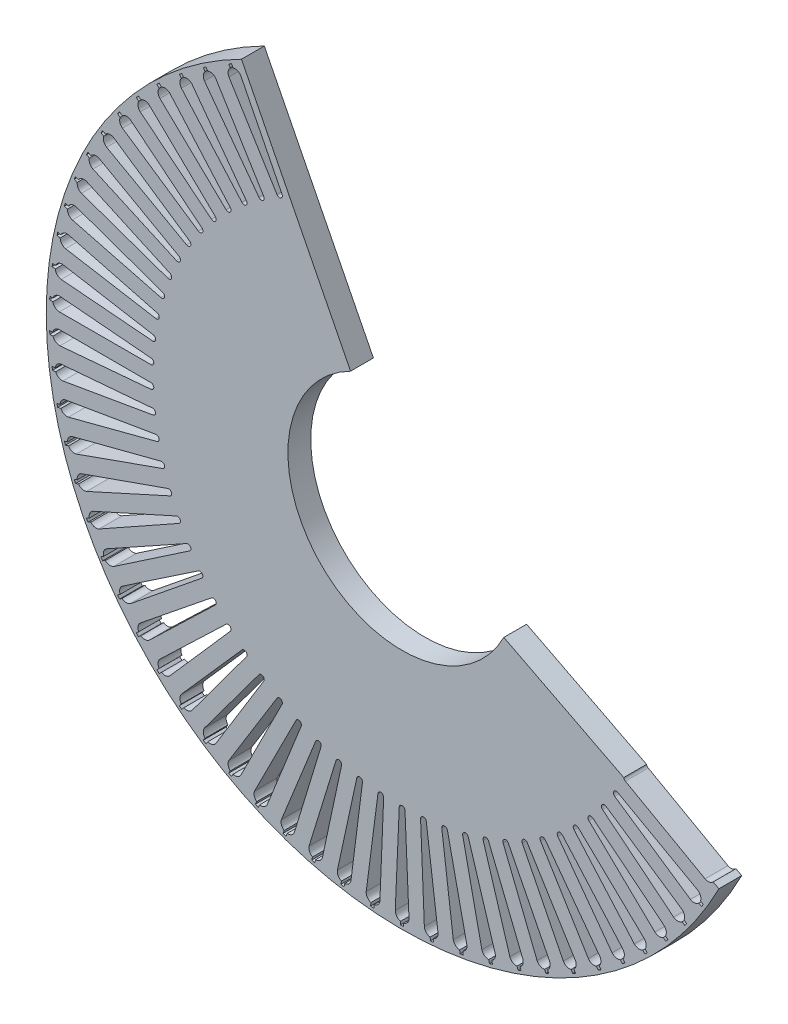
SolidWorks part; units mm, degrees
ref_plane "Přední rovina" through (0, 0, 0) normal (0, 0, 1) x (1, 0, 0)
ref_plane "Horní rovina" through (0, 0, 0) normal (0, 1, 0) x (1, 0, 0)
ref_plane "Pravá rovina" through (0, 0, 0) normal (1, 0, 0) x (0, 0, -1)
sketch "Skica2" plane through (0, 0, 0) normal (0, 0, 1) x (1, 0, 0)
  circle A0 centre (0, 0) radius 25
  circle A1 centre (0, 0) radius 77.9
extrude "Přidat vysunutím1" add sketch "Skica2" along normal blind 5
sketch "Skica1" plane through (0, 0, 0) normal (0, 0, 1) x (1, 0, 0)
  line L0 (0, 94.0554) -> (0, -97.5291) construction
  line L1 (-111.4898, 0) -> (131.9321, 0) construction
  line L2 (0, 77.9) -> (0, 77.2)
  line L3 (-0.35, 77.2) -> (0.35, 77.2)
  line L4 (0.35, 77.2) -> (0.35, 76.5)
  line L5 (0, 76.5) -> (0, 75.0365)
  line L6 (0, 75.0365) -> (0, 55.0346)
  line L7 (1.5047, 75.0365) -> (0.63, 55.0346)
  line L8 (-1.5047, 75.0365) -> (-0.63, 55.0346)
  line L9 (-0.35, 77.2) -> (-0.35, 76.5)
  line L10 (4.8642, 74.8938) -> (4.0395, 54.8898)
  line L11 (7.8629, 74.6386) -> (5.295, 54.7829)
  line L12 (6.8958, 76.8922) -> (6.8364, 76.1947)
  line L13 (6.1983, 76.9516) -> (6.1389, 76.2541)
  line L14 (6.1983, 76.9516) -> (6.8958, 76.8922)
  line L15 (11.1981, 74.2115) -> (8.68, 54.3495)
  line L16 (14.1643, 73.7029) -> (9.9218, 54.1365)
  line L17 (13.3918, 76.0304) -> (13.2735, 75.3405)
  line L18 (12.7019, 76.1487) -> (12.5836, 75.4588)
  line L19 (12.7019, 76.1487) -> (13.3918, 76.0304)
  line L20 (17.4514, 72.9945) -> (13.2578, 53.4176)
  line L21 (20.3637, 72.2362) -> (14.4772, 53.1001)
  line L22 (19.7914, 74.6208) -> (19.615, 73.9434)
  line L23 (19.114, 74.7972) -> (18.9376, 74.1198)
  line L24 (19.114, 74.7972) -> (19.7914, 74.6208)
  line L25 (23.5789, 71.2515) -> (17.7402, 52.1008)
  line L26 (26.4164, 70.249) -> (18.9282, 51.681)
  line L27 (26.0484, 72.6735) -> (25.8152, 72.0135)
  line L28 (25.3884, 72.9067) -> (25.1552, 72.2467)
  line L29 (25.3884, 72.9067) -> (26.0484, 72.6735)
  line L30 (29.5365, 68.9952) -> (22.0948, 50.4086)
  line L31 (32.2788, 67.7556) -> (23.2429, 49.8896)
  line L32 (32.1177, 70.2027) -> (31.8294, 69.5648)
  line L33 (31.4798, 70.491) -> (31.1915, 69.8531)
  line L34 (31.4798, 70.491) -> (32.1177, 70.2027)
  line L35 (35.2813, 66.2418) -> (26.2901, 48.3533)
  line L36 (37.9086, 64.7741) -> (27.3901, 47.7388)
  line L37 (37.9556, 67.226) -> (37.6142, 66.6149)
  line L38 (37.3445, 67.5674) -> (37.0031, 66.9563)
  line L39 (37.3445, 67.5674) -> (37.9556, 67.226)
  line L40 (40.7719, 63.0111) -> (30.296, 45.9495)
  line L41 (43.2653, 61.3259) -> (31.34, 45.2439)
  line L42 (43.52, 63.765) -> (43.128, 63.185)
  line L43 (42.9401, 64.1569) -> (42.5481, 63.577)
  line L44 (42.9401, 64.1569) -> (43.52, 63.765)
  line L45 (45.9687, 59.3264) -> (34.0837, 43.2147)
  line L46 (48.3102, 57.4358) -> (35.064, 42.4231)
  line L47 (48.7709, 59.8445) -> (48.3311, 59.2999)
  line L48 (48.2263, 60.2842) -> (47.7865, 59.7396)
  line L49 (48.2263, 60.2842) -> (48.7709, 59.8445)
  line L50 (50.8343, 55.2143) -> (37.6258, 40.1685)
  line L51 (53.007, 53.1319) -> (38.5354, 39.2967)
  line L52 (53.6704, 55.4928) -> (53.186, 54.9875)
  line L53 (53.165, 55.9772) -> (52.6806, 55.4718)
  line L54 (53.165, 55.9772) -> (53.6704, 55.4928)
  line L55 (55.3337, 50.7043) -> (40.8967, 36.8329)
  line L56 (57.322, 48.4452) -> (41.7292, 35.8871)
  line L57 (58.1831, 50.7414) -> (57.6577, 50.2789)
  line L58 (57.7207, 51.2668) -> (57.1952, 50.8044)
  line L59 (57.7207, 51.2668) -> (58.1831, 50.7414)
  line L60 (59.4344, 45.829) -> (43.8731, 33.2319)
  line L61 (61.2239, 43.4094) -> (44.6223, 32.2189)
  line L62 (62.2767, 45.6243) -> (61.7139, 45.208)
  line L63 (61.8605, 46.1871) -> (61.2977, 45.7708)
  line L64 (61.8605, 46.1871) -> (62.2767, 45.6243)
  line L65 (63.1068, 40.6235) -> (46.5333, 29.3915)
  line L66 (64.6847, 38.0609) -> (47.1939, 28.3186)
  line L67 (65.9216, 40.1785) -> (65.3255, 39.8115)
  line L68 (65.5545, 40.7746) -> (64.9585, 40.4075)
  line L69 (65.5545, 40.7746) -> (65.9216, 40.1785)
  line L70 (66.3246, 35.1253) -> (48.8582, 25.3393)
  line L71 (67.6795, 32.4381) -> (49.4255, 24.2143)
  line L72 (69.0914, 34.4432) -> (68.4664, 34.1281)
  line L73 (68.7763, 35.0683) -> (68.1513, 34.7531)
  line L74 (68.7763, 35.0683) -> (69.0914, 34.4432)
  line L75 (69.0645, 29.3741) -> (50.8311, 21.1046)
  line L76 (70.1866, 26.5816) -> (51.3009, 19.9354)
  line L77 (71.7635, 28.4598) -> (71.114, 28.1988)
  line L78 (71.5025, 29.1093) -> (70.853, 28.8483)
  line L79 (71.5025, 29.1093) -> (71.7635, 28.4598)
  line L80 (71.3068, 23.4112) -> (52.4378, 16.7178)
  line L81 (72.1881, 20.5336) -> (52.8068, 15.513)
  line L82 (73.9186, 22.2713) -> (73.2492, 22.0663)
  line L83 (73.7136, 22.9406) -> (73.0443, 22.7356)
  line L84 (73.7136, 22.9406) -> (73.9186, 22.2713)
  line L85 (73.0353, 17.2796) -> (53.6667, 12.2105)
  line L86 (73.6694, 14.3377) -> (53.9321, 10.9788)
  line L87 (75.541, 15.9223) -> (74.8567, 15.7748)
  line L88 (75.3935, 16.6066) -> (74.7092, 16.4591)
  line L89 (75.3935, 16.6066) -> (75.541, 15.9223)
  line L90 (74.2376, 11.0235) -> (54.5088, 7.6153)
  line L91 (74.6199, 8.0384) -> (54.6689, 6.3655)
  line L92 (76.6192, 9.4586) -> (75.9248, 9.3697)
  line L93 (76.5303, 10.1529) -> (75.8359, 10.064)
  line L94 (76.5303, 10.1529) -> (76.6192, 9.4586)
  line L95 (74.9051, 4.688) -> (54.9583, 2.9652)
  line L96 (75.0328, 1.6813) -> (55.0118, 1.7063)
  line L97 (77.1453, 2.9268) -> (76.4459, 2.8971)
  line L98 (77.1156, 3.6261) -> (76.4162, 3.5964)
  line L99 (77.1156, 3.6261) -> (77.1453, 2.9268)
  line L100 (75.0328, -1.6813) -> (55.0118, -1.7063)
  line L101 (74.9051, -4.688) -> (54.9583, -2.9652)
  line L102 (77.1156, -3.6261) -> (76.4162, -3.5964)
  line L103 (77.1453, -2.9268) -> (76.4459, -2.8971)
  line L104 (77.1453, -2.9268) -> (77.1156, -3.6261)
  line L105 (74.6199, -8.0384) -> (54.6689, -6.3655)
  line L106 (74.2376, -11.0235) -> (54.5088, -7.6153)
  line L107 (76.5303, -10.1529) -> (75.8359, -10.064)
  line L108 (76.6192, -9.4586) -> (75.9248, -9.3697)
  line L109 (76.6192, -9.4586) -> (76.5303, -10.1529)
  line L110 (73.6694, -14.3377) -> (53.9321, -10.9788)
  line L111 (73.0353, -17.2796) -> (53.6667, -12.2105)
  line L112 (75.3935, -16.6066) -> (74.7092, -16.4591)
  line L113 (75.541, -15.9223) -> (74.8567, -15.7748)
  line L114 (75.541, -15.9223) -> (75.3935, -16.6066)
  line L115 (72.1881, -20.5336) -> (52.8068, -15.513)
  line L116 (71.3068, -23.4112) -> (52.4378, -16.7178)
  line L117 (73.7136, -22.9406) -> (73.0443, -22.7356)
  line L118 (73.9186, -22.2713) -> (73.2492, -22.0663)
  line L119 (73.9186, -22.2713) -> (73.7136, -22.9406)
  line L120 (70.1866, -26.5816) -> (51.3009, -19.9354)
  line L121 (69.0645, -29.3741) -> (50.8311, -21.1046)
  line L122 (71.5025, -29.1093) -> (70.853, -28.8483)
  line L123 (71.7635, -28.4598) -> (71.114, -28.1988)
  line L124 (71.7635, -28.4598) -> (71.5025, -29.1093)
  line L125 (67.6795, -32.4381) -> (49.4255, -24.2143)
  line L126 (66.3246, -35.1253) -> (48.8582, -25.3393)
  line L127 (68.7763, -35.0683) -> (68.1513, -34.7531)
  line L128 (69.0914, -34.4432) -> (68.4664, -34.1281)
  line L129 (69.0914, -34.4432) -> (68.7763, -35.0683)
  line L130 (64.6847, -38.0609) -> (47.1939, -28.3186)
  line L131 (63.1068, -40.6235) -> (46.5333, -29.3915)
  line L132 (65.5545, -40.7746) -> (64.9585, -40.4075)
  line L133 (65.9216, -40.1785) -> (65.3255, -39.8115)
  line L134 (65.9216, -40.1785) -> (65.5545, -40.7746)
  line L135 (61.2239, -43.4094) -> (44.6223, -32.2189)
  line L136 (59.4344, -45.829) -> (43.8731, -33.2319)
  line L137 (61.8605, -46.1871) -> (61.2977, -45.7708)
  line L138 (62.2767, -45.6243) -> (61.7139, -45.208)
  line L139 (62.2767, -45.6243) -> (61.8605, -46.1871)
  line L140 (57.322, -48.4452) -> (41.7292, -35.8871)
  line L141 (55.3337, -50.7043) -> (40.8967, -36.8329)
  line L142 (57.7207, -51.2668) -> (57.1952, -50.8044)
  line L143 (58.1831, -50.7414) -> (57.6577, -50.2789)
  line L144 (58.1831, -50.7414) -> (57.7207, -51.2668)
  line L145 (53.007, -53.1319) -> (38.5354, -39.2967)
  line L146 (50.8343, -55.2143) -> (37.6258, -40.1685)
  line L147 (53.165, -55.9772) -> (52.6806, -55.4718)
  line L148 (53.6704, -55.4928) -> (53.186, -54.9875)
  line L149 (53.6704, -55.4928) -> (53.165, -55.9772)
  line L150 (48.3102, -57.4358) -> (35.064, -42.4231)
  line L151 (45.9687, -59.3264) -> (34.0837, -43.2147)
  line L152 (48.2263, -60.2842) -> (47.7865, -59.7396)
  line L153 (48.7709, -59.8445) -> (48.3311, -59.2999)
  line L154 (48.7709, -59.8445) -> (48.2263, -60.2842)
  line L155 (43.2653, -61.3259) -> (31.34, -45.2439)
  line L156 (40.7719, -63.0111) -> (30.296, -45.9495)
  line L157 (42.9401, -64.1569) -> (42.5481, -63.577)
  line L158 (43.52, -63.765) -> (43.128, -63.185)
  line L159 (43.52, -63.765) -> (42.9401, -64.1569)
  line L160 (37.9086, -64.7741) -> (27.3901, -47.7388)
  line L161 (35.2813, -66.2418) -> (26.2901, -48.3533)
  line L162 (37.3445, -67.5674) -> (37.0031, -66.9563)
  line L163 (37.9556, -67.226) -> (37.6142, -66.6149)
  line L164 (37.9556, -67.226) -> (37.3445, -67.5674)
  line L165 (32.2788, -67.7556) -> (23.2429, -49.8896)
  line L166 (29.5365, -68.9952) -> (22.0948, -50.4086)
  line L167 (31.4798, -70.491) -> (31.1915, -69.8531)
  line L168 (32.1177, -70.2027) -> (31.8294, -69.5648)
  line L169 (32.1177, -70.2027) -> (31.4798, -70.491)
  line L170 (26.4164, -70.249) -> (18.9282, -51.681)
  line L171 (23.5789, -71.2515) -> (17.7402, -52.1008)
  line L172 (25.3884, -72.9067) -> (25.1552, -72.2467)
  line L173 (26.0484, -72.6735) -> (25.8152, -72.0135)
  line L174 (26.0484, -72.6735) -> (25.3884, -72.9067)
  line L175 (20.3637, -72.2362) -> (14.4772, -53.1001)
  line L176 (17.4514, -72.9945) -> (13.2578, -53.4176)
  line L177 (19.114, -74.7972) -> (18.9376, -74.1198)
  line L178 (19.7914, -74.6208) -> (19.615, -73.9434)
  line L179 (19.7914, -74.6208) -> (19.114, -74.7972)
  line L180 (14.1643, -73.7029) -> (9.9218, -54.1365)
  line L181 (11.1981, -74.2115) -> (8.68, -54.3495)
  line L182 (12.7019, -76.1487) -> (12.5836, -75.4588)
  line L183 (13.3918, -76.0304) -> (13.2735, -75.3405)
  line L184 (13.3918, -76.0304) -> (12.7019, -76.1487)
  line L185 (7.8629, -74.6386) -> (5.295, -54.7829)
  line L186 (4.8642, -74.8938) -> (4.0395, -54.8898)
  line L187 (6.1983, -76.9516) -> (6.1389, -76.2541)
  line L188 (6.8958, -76.8922) -> (6.8364, -76.1947)
  line L189 (6.8958, -76.8922) -> (6.1983, -76.9516)
  line L190 (1.5047, -75.0365) -> (0.63, -55.0346)
  line L191 (-1.5047, -75.0365) -> (-0.63, -55.0346)
  line L192 (-0.35, -77.2) -> (-0.35, -76.5)
  line L193 (0.35, -77.2) -> (0.35, -76.5)
  line L194 (0.35, -77.2) -> (-0.35, -77.2)
  line L195 (-4.8642, -74.8938) -> (-4.0395, -54.8898)
  line L196 (-7.8629, -74.6386) -> (-5.295, -54.7829)
  line L197 (-6.8958, -76.8922) -> (-6.8364, -76.1947)
  line L198 (-6.1983, -76.9516) -> (-6.1389, -76.2541)
  line L199 (-6.1983, -76.9516) -> (-6.8958, -76.8922)
  line L200 (-11.1981, -74.2115) -> (-8.68, -54.3495)
  line L201 (-14.1643, -73.7029) -> (-9.9218, -54.1365)
  line L202 (-13.3918, -76.0304) -> (-13.2735, -75.3405)
  line L203 (-12.7019, -76.1487) -> (-12.5836, -75.4588)
  line L204 (-12.7019, -76.1487) -> (-13.3918, -76.0304)
  line L205 (-17.4514, -72.9945) -> (-13.2578, -53.4176)
  line L206 (-20.3637, -72.2362) -> (-14.4772, -53.1001)
  line L207 (-19.7914, -74.6208) -> (-19.615, -73.9434)
  line L208 (-19.114, -74.7972) -> (-18.9376, -74.1198)
  line L209 (-19.114, -74.7972) -> (-19.7914, -74.6208)
  line L210 (-23.5789, -71.2515) -> (-17.7402, -52.1008)
  line L211 (-26.4164, -70.249) -> (-18.9282, -51.681)
  line L212 (-26.0484, -72.6735) -> (-25.8152, -72.0135)
  line L213 (-25.3884, -72.9067) -> (-25.1552, -72.2467)
  line L214 (-25.3884, -72.9067) -> (-26.0484, -72.6735)
  line L215 (-29.5365, -68.9952) -> (-22.0948, -50.4086)
  line L216 (-32.2788, -67.7556) -> (-23.2429, -49.8896)
  line L217 (-32.1177, -70.2027) -> (-31.8294, -69.5648)
  line L218 (-31.4798, -70.491) -> (-31.1915, -69.8531)
  line L219 (-31.4798, -70.491) -> (-32.1177, -70.2027)
  line L220 (-35.2813, -66.2418) -> (-26.2901, -48.3533)
  line L221 (-37.9086, -64.7741) -> (-27.3901, -47.7388)
  line L222 (-37.9556, -67.226) -> (-37.6142, -66.6149)
  line L223 (-37.3445, -67.5674) -> (-37.0031, -66.9563)
  line L224 (-37.3445, -67.5674) -> (-37.9556, -67.226)
  line L225 (-40.7719, -63.0111) -> (-30.296, -45.9495)
  line L226 (-43.2653, -61.3259) -> (-31.34, -45.2439)
  line L227 (-43.52, -63.765) -> (-43.128, -63.185)
  line L228 (-42.9401, -64.1569) -> (-42.5481, -63.577)
  line L229 (-42.9401, -64.1569) -> (-43.52, -63.765)
  line L230 (-45.9687, -59.3264) -> (-34.0837, -43.2147)
  line L231 (-48.3102, -57.4358) -> (-35.064, -42.4231)
  line L232 (-48.7709, -59.8445) -> (-48.3311, -59.2999)
  line L233 (-48.2263, -60.2842) -> (-47.7865, -59.7396)
  line L234 (-48.2263, -60.2842) -> (-48.7709, -59.8445)
  line L235 (-50.8343, -55.2143) -> (-37.6258, -40.1685)
  line L236 (-53.007, -53.1319) -> (-38.5354, -39.2967)
  line L237 (-53.6704, -55.4928) -> (-53.186, -54.9875)
  line L238 (-53.165, -55.9772) -> (-52.6806, -55.4718)
  line L239 (-53.165, -55.9772) -> (-53.6704, -55.4928)
  line L240 (-55.3337, -50.7043) -> (-40.8967, -36.8329)
  line L241 (-57.322, -48.4452) -> (-41.7292, -35.8871)
  line L242 (-58.1831, -50.7414) -> (-57.6577, -50.2789)
  line L243 (-57.7207, -51.2668) -> (-57.1952, -50.8044)
  line L244 (-57.7207, -51.2668) -> (-58.1831, -50.7414)
  line L245 (-59.4344, -45.829) -> (-43.8731, -33.2319)
  line L246 (-61.2239, -43.4094) -> (-44.6223, -32.2189)
  line L247 (-62.2767, -45.6243) -> (-61.7139, -45.208)
  line L248 (-61.8605, -46.1871) -> (-61.2977, -45.7708)
  line L249 (-61.8605, -46.1871) -> (-62.2767, -45.6243)
  line L250 (-63.1068, -40.6235) -> (-46.5333, -29.3915)
  line L251 (-64.6847, -38.0609) -> (-47.1939, -28.3186)
  line L252 (-65.9216, -40.1785) -> (-65.3255, -39.8115)
  line L253 (-65.5545, -40.7746) -> (-64.9585, -40.4075)
  line L254 (-65.5545, -40.7746) -> (-65.9216, -40.1785)
  line L255 (-66.3246, -35.1253) -> (-48.8582, -25.3393)
  line L256 (-67.6795, -32.4381) -> (-49.4255, -24.2143)
  line L257 (-69.0914, -34.4432) -> (-68.4664, -34.1281)
  line L258 (-68.7763, -35.0683) -> (-68.1513, -34.7531)
  line L259 (-68.7763, -35.0683) -> (-69.0914, -34.4432)
  line L260 (-69.0645, -29.3741) -> (-50.8311, -21.1046)
  line L261 (-70.1866, -26.5816) -> (-51.3009, -19.9354)
  line L262 (-71.7635, -28.4598) -> (-71.114, -28.1988)
  line L263 (-71.5025, -29.1093) -> (-70.853, -28.8483)
  line L264 (-71.5025, -29.1093) -> (-71.7635, -28.4598)
  line L265 (-71.3068, -23.4112) -> (-52.4378, -16.7178)
  line L266 (-72.1881, -20.5336) -> (-52.8068, -15.513)
  line L267 (-73.9186, -22.2713) -> (-73.2492, -22.0663)
  line L268 (-73.7136, -22.9406) -> (-73.0443, -22.7356)
  line L269 (-73.7136, -22.9406) -> (-73.9186, -22.2713)
  line L270 (-73.0353, -17.2796) -> (-53.6667, -12.2105)
  line L271 (-73.6694, -14.3377) -> (-53.9321, -10.9788)
  line L272 (-75.541, -15.9223) -> (-74.8567, -15.7748)
  line L273 (-75.3935, -16.6066) -> (-74.7092, -16.4591)
  line L274 (-75.3935, -16.6066) -> (-75.541, -15.9223)
  line L275 (-74.2376, -11.0235) -> (-54.5088, -7.6153)
  line L276 (-74.6199, -8.0384) -> (-54.6689, -6.3655)
  line L277 (-76.6192, -9.4586) -> (-75.9248, -9.3697)
  line L278 (-76.5303, -10.1529) -> (-75.8359, -10.064)
  line L279 (-76.5303, -10.1529) -> (-76.6192, -9.4586)
  line L280 (-74.9051, -4.688) -> (-54.9583, -2.9652)
  line L281 (-75.0328, -1.6813) -> (-55.0118, -1.7063)
  line L282 (-77.1453, -2.9268) -> (-76.4459, -2.8971)
  line L283 (-77.1156, -3.6261) -> (-76.4162, -3.5964)
  line L284 (-77.1156, -3.6261) -> (-77.1453, -2.9268)
  line L285 (-75.0328, 1.6813) -> (-55.0118, 1.7063)
  line L286 (-74.9051, 4.688) -> (-54.9583, 2.9652)
  line L287 (-77.1156, 3.6261) -> (-76.4162, 3.5964)
  line L288 (-77.1453, 2.9268) -> (-76.4459, 2.8971)
  line L289 (-77.1453, 2.9268) -> (-77.1156, 3.6261)
  line L290 (-74.6199, 8.0384) -> (-54.6689, 6.3655)
  line L291 (-74.2376, 11.0235) -> (-54.5088, 7.6153)
  line L292 (-76.5303, 10.1529) -> (-75.8359, 10.064)
  line L293 (-76.6192, 9.4586) -> (-75.9248, 9.3697)
  line L294 (-76.6192, 9.4586) -> (-76.5303, 10.1529)
  line L295 (-73.6694, 14.3377) -> (-53.9321, 10.9788)
  line L296 (-73.0353, 17.2796) -> (-53.6667, 12.2105)
  line L297 (-75.3935, 16.6066) -> (-74.7092, 16.4591)
  line L298 (-75.541, 15.9223) -> (-74.8567, 15.7748)
  line L299 (-75.541, 15.9223) -> (-75.3935, 16.6066)
  line L300 (-72.1881, 20.5336) -> (-52.8068, 15.513)
  line L301 (-71.3068, 23.4112) -> (-52.4378, 16.7178)
  line L302 (-73.7136, 22.9406) -> (-73.0443, 22.7356)
  line L303 (-73.9186, 22.2713) -> (-73.2492, 22.0663)
  line L304 (-73.9186, 22.2713) -> (-73.7136, 22.9406)
  line L305 (-70.1866, 26.5816) -> (-51.3009, 19.9354)
  line L306 (-69.0645, 29.3741) -> (-50.8311, 21.1046)
  line L307 (-71.5025, 29.1093) -> (-70.853, 28.8483)
  line L308 (-71.7635, 28.4598) -> (-71.114, 28.1988)
  line L309 (-71.7635, 28.4598) -> (-71.5025, 29.1093)
  line L310 (-67.6795, 32.4381) -> (-49.4255, 24.2143)
  line L311 (-66.3246, 35.1253) -> (-48.8582, 25.3393)
  line L312 (-68.7763, 35.0683) -> (-68.1513, 34.7531)
  line L313 (-69.0914, 34.4432) -> (-68.4664, 34.1281)
  line L314 (-69.0914, 34.4432) -> (-68.7763, 35.0683)
  line L315 (-64.6847, 38.0609) -> (-47.1939, 28.3186)
  line L316 (-63.1068, 40.6235) -> (-46.5333, 29.3915)
  line L317 (-65.5545, 40.7746) -> (-64.9585, 40.4075)
  line L318 (-65.9216, 40.1785) -> (-65.3255, 39.8115)
  line L319 (-65.9216, 40.1785) -> (-65.5545, 40.7746)
  line L320 (-61.2239, 43.4094) -> (-44.6223, 32.2189)
  line L321 (-59.4344, 45.829) -> (-43.8731, 33.2319)
  line L322 (-61.8605, 46.1871) -> (-61.2977, 45.7708)
  line L323 (-62.2767, 45.6243) -> (-61.7139, 45.208)
  line L324 (-62.2767, 45.6243) -> (-61.8605, 46.1871)
  line L325 (-57.322, 48.4452) -> (-41.7292, 35.8871)
  line L326 (-55.3337, 50.7043) -> (-40.8967, 36.8329)
  line L327 (-57.7207, 51.2668) -> (-57.1952, 50.8044)
  line L328 (-58.1831, 50.7414) -> (-57.6577, 50.2789)
  line L329 (-58.1831, 50.7414) -> (-57.7207, 51.2668)
  line L330 (-53.007, 53.1319) -> (-38.5354, 39.2967)
  line L331 (-50.8343, 55.2143) -> (-37.6258, 40.1685)
  line L332 (-53.165, 55.9772) -> (-52.6806, 55.4718)
  line L333 (-53.6704, 55.4928) -> (-53.186, 54.9875)
  line L334 (-53.6704, 55.4928) -> (-53.165, 55.9772)
  line L335 (-48.3102, 57.4358) -> (-35.064, 42.4231)
  line L336 (-45.9687, 59.3264) -> (-34.0837, 43.2147)
  line L337 (-48.2263, 60.2842) -> (-47.7865, 59.7396)
  line L338 (-48.7709, 59.8445) -> (-48.3311, 59.2999)
  line L339 (-48.7709, 59.8445) -> (-48.2263, 60.2842)
  line L340 (-43.2653, 61.3259) -> (-31.34, 45.2439)
  line L341 (-40.7719, 63.0111) -> (-30.296, 45.9495)
  line L342 (-42.9401, 64.1569) -> (-42.5481, 63.577)
  line L343 (-43.52, 63.765) -> (-43.128, 63.185)
  line L344 (-43.52, 63.765) -> (-42.9401, 64.1569)
  line L345 (-37.9086, 64.7741) -> (-27.3901, 47.7388)
  line L346 (-35.2813, 66.2418) -> (-26.2901, 48.3533)
  line L347 (-37.3445, 67.5674) -> (-37.0031, 66.9563)
  line L348 (-37.9556, 67.226) -> (-37.6142, 66.6149)
  line L349 (-37.9556, 67.226) -> (-37.3445, 67.5674)
  line L350 (-32.2788, 67.7556) -> (-23.2429, 49.8896)
  line L351 (-29.5365, 68.9952) -> (-22.0948, 50.4086)
  line L352 (-31.4798, 70.491) -> (-31.1915, 69.8531)
  line L353 (-32.1177, 70.2027) -> (-31.8294, 69.5648)
  line L354 (-32.1177, 70.2027) -> (-31.4798, 70.491)
  line L355 (-26.4164, 70.249) -> (-18.9282, 51.681)
  line L356 (-23.5789, 71.2515) -> (-17.7402, 52.1008)
  line L357 (-25.3884, 72.9067) -> (-25.1552, 72.2467)
  line L358 (-26.0484, 72.6735) -> (-25.8152, 72.0135)
  line L359 (-26.0484, 72.6735) -> (-25.3884, 72.9067)
  line L360 (-20.3637, 72.2362) -> (-14.4772, 53.1001)
  line L361 (-17.4514, 72.9945) -> (-13.2578, 53.4176)
  line L362 (-19.114, 74.7972) -> (-18.9376, 74.1198)
  line L363 (-19.7914, 74.6208) -> (-19.615, 73.9434)
  line L364 (-19.7914, 74.6208) -> (-19.114, 74.7972)
  line L365 (-14.1643, 73.7029) -> (-9.9218, 54.1365)
  line L366 (-11.1981, 74.2115) -> (-8.68, 54.3495)
  line L367 (-12.7019, 76.1487) -> (-12.5836, 75.4588)
  line L368 (-13.3918, 76.0304) -> (-13.2735, 75.3405)
  line L369 (-13.3918, 76.0304) -> (-12.7019, 76.1487)
  line L370 (-7.8629, 74.6386) -> (-5.295, 54.7829)
  line L371 (-4.8642, 74.8938) -> (-4.0395, 54.8898)
  line L372 (-6.1983, 76.9516) -> (-6.1389, 76.2541)
  line L373 (-6.8958, 76.8922) -> (-6.8364, 76.1947)
  line L374 (-6.8958, 76.8922) -> (-6.1983, 76.9516)
  circle A0 centre (0, 0) radius 25
  circle A1 centre (0, 0) radius 77.9
  arc A2 (1.499, 74.9052) -> (0.35, 76.5) centre (0, 75.0365) ccw
  arc A3 (-0.63, 55.0346) -> (0.63, 55.0346) centre (0, 55.0346) ccw
  arc A4 (-0.35, 76.5) -> (-1.499, 74.9052) centre (0, 75.0365) ccw
  arc A5 (4.0395, 54.8898) -> (5.295, 54.7829) centre (4.6673, 54.8364) ccw
  arc A6 (6.1389, 76.2541) -> (4.8588, 74.7624) centre (6.3635, 74.7662) ccw
  arc A7 (7.846, 74.5082) -> (6.8364, 76.1947) centre (6.3635, 74.7662) ccw
  arc A8 (8.68, 54.3495) -> (9.9218, 54.1365) centre (9.3009, 54.243) ccw
  arc A9 (12.5836, 75.4588) -> (11.1816, 74.0811) centre (12.6812, 73.9572) ccw
  arc A10 (14.1365, 73.5744) -> (13.2735, 75.3405) centre (12.6812, 73.9572) ccw
  arc A11 (13.2578, 53.4176) -> (14.4772, 53.1001) centre (13.8675, 53.2588) ccw
  arc A12 (18.9376, 74.1198) -> (17.4238, 72.8659) centre (18.9076, 72.6153) ccw
  arc A13 (20.3251, 72.1105) -> (19.615, 73.9434) centre (18.9076, 72.6153) ccw
  arc A14 (17.7402, 52.1008) -> (18.9282, 51.681) centre (18.3342, 51.8909) ccw
  arc A15 (25.1552, 72.2467) -> (23.5405, 71.1258) centre (24.9977, 70.7503) ccw
  arc A16 (26.3673, 70.127) -> (25.8152, 72.0135) centre (24.9977, 70.7503) ccw
  arc A17 (22.0948, 50.4086) -> (23.2429, 49.8896) centre (22.6688, 50.1491) ccw
  arc A18 (31.1915, 69.8531) -> (29.4876, 68.8732) centre (30.9076, 68.3754) ccw
  arc A19 (32.2195, 67.6383) -> (31.8294, 69.5648) centre (30.9076, 68.3754) ccw
  arc A20 (26.2901, 48.3533) -> (27.3901, 47.7388) centre (26.8401, 48.046) ccw
  arc A21 (37.0031, 66.9563) -> (35.2222, 66.1243) centre (36.5949, 65.508) ccw
  arc A22 (37.8395, 64.6622) -> (37.6142, 66.6149) centre (36.5949, 65.508) ccw
  arc A23 (30.296, 45.9495) -> (31.34, 45.2439) centre (30.818, 45.5967) ccw
  arc A24 (42.5481, 63.577) -> (40.7031, 62.8991) centre (42.0186, 62.1685) ccw
  arc A25 (43.1869, 61.2203) -> (43.128, 63.185) centre (42.0186, 62.1685) ccw
  arc A26 (34.0837, 43.2147) -> (35.064, 42.4231) centre (34.5739, 42.8189) ccw
  arc A27 (47.7865, 59.7396) -> (45.8907, 59.2206) centre (47.1394, 58.3811) ccw
  arc A28 (48.2232, 57.3372) -> (48.3311, 59.2999) centre (47.1394, 58.3811) ccw
  arc A29 (37.6258, 40.1685) -> (38.5354, 39.2967) centre (38.0806, 39.7326) ccw
  arc A30 (52.6806, 55.4718) -> (50.7476, 55.1155) centre (51.9207, 54.1731) ccw
  arc A31 (52.912, 53.041) -> (53.186, 54.9875) centre (51.9207, 54.1731) ccw
  arc A32 (40.8967, 36.8329) -> (41.7292, 35.8871) centre (41.313, 36.36) ccw
  arc A33 (57.1952, 50.8044) -> (55.2389, 50.6132) centre (56.3278, 49.5747) ccw
  arc A34 (57.2196, 48.3627) -> (57.6577, 50.2789) centre (56.3278, 49.5747) ccw
  arc A35 (43.8731, 33.2319) -> (44.6223, 32.2189) centre (44.2477, 32.7254) ccw
  arc A36 (61.2977, 45.7708) -> (59.3322, 45.7463) centre (60.3292, 44.6192) ccw
  arc A37 (61.1149, 43.3359) -> (61.7139, 45.208) centre (60.3292, 44.6192) ccw
  arc A38 (46.5333, 29.3915) -> (47.1939, 28.3186) centre (46.8636, 28.8551) ccw
  arc A39 (64.9585, 40.4075) -> (62.998, 40.5498) centre (63.8958, 39.3422) ccw
  arc A40 (64.5699, 37.9969) -> (65.3255, 39.8115) centre (63.8958, 39.3422) ccw
  arc A41 (48.8582, 25.3393) -> (49.4255, 24.2143) centre (49.1418, 24.7768) ccw
  arc A42 (68.1513, 34.7531) -> (66.2099, 35.0611) centre (67.0021, 33.7817) ccw
  arc A43 (67.5596, 32.3841) -> (68.4664, 34.1281) centre (67.0021, 33.7817) ccw
  arc A44 (50.8311, 21.1046) -> (51.3009, 19.9354) centre (51.066, 20.52) ccw
  arc A45 (70.853, 28.8483) -> (68.9448, 29.3198) centre (69.6256, 27.9779) ccw
  arc A46 (70.0626, 26.538) -> (71.114, 28.1988) centre (69.6256, 27.9779) ccw
  arc A47 (52.4378, 16.7178) -> (52.8068, 15.513) centre (52.6223, 16.1154) ccw
  arc A48 (73.0443, 22.7356) -> (71.1829, 23.3672) centre (71.7474, 21.9724) ccw
  arc A49 (72.0608, 20.5007) -> (73.2492, 22.0663) centre (71.7474, 21.9724) ccw
  arc A50 (53.6667, 12.2105) -> (53.9321, 10.9788) centre (53.7994, 11.5947) ccw
  arc A51 (74.7092, 16.4591) -> (72.9081, 17.2463) centre (73.3524, 15.8086) ccw
  arc A52 (73.5397, 14.3156) -> (74.8567, 15.7748) centre (73.3524, 15.8086) ccw
  arc A53 (54.5088, 7.6153) -> (54.6689, 6.3655) centre (54.5889, 6.9904) ccw
  arc A54 (75.8359, 10.064) -> (74.1081, 11.0011) centre (74.4288, 9.531) ccw
  arc A55 (74.4889, 8.0274) -> (75.9248, 9.3697) centre (74.4288, 9.531) ccw
  arc A56 (54.9583, 2.9652) -> (55.0118, 1.7063) centre (54.985, 2.3357) ccw
  arc A57 (76.4162, 3.5964) -> (74.7741, 4.6767) centre (74.9689, 3.1846) ccw
  arc A58 (74.9013, 1.6814) -> (76.4459, 2.8971) centre (74.9689, 3.1846) ccw
  arc A59 (55.0118, -1.7063) -> (54.9583, -2.9652) centre (54.985, -2.3357) ccw
  arc A60 (76.4459, -2.8971) -> (74.9013, -1.6814) centre (74.9689, -3.1846) ccw
  arc A61 (74.7741, -4.6767) -> (76.4162, -3.5964) centre (74.9689, -3.1846) ccw
  arc A62 (54.6689, -6.3655) -> (54.5088, -7.6153) centre (54.5889, -6.9904) ccw
  arc A63 (75.9248, -9.3697) -> (74.4889, -8.0274) centre (74.4288, -9.531) ccw
  arc A64 (74.1081, -11.0011) -> (75.8359, -10.064) centre (74.4288, -9.531) ccw
  arc A65 (53.9321, -10.9788) -> (53.6667, -12.2105) centre (53.7994, -11.5947) ccw
  arc A66 (74.8567, -15.7748) -> (73.5397, -14.3156) centre (73.3524, -15.8086) ccw
  arc A67 (72.9081, -17.2463) -> (74.7092, -16.4591) centre (73.3524, -15.8086) ccw
  arc A68 (52.8068, -15.513) -> (52.4378, -16.7178) centre (52.6223, -16.1154) ccw
  arc A69 (73.2492, -22.0663) -> (72.0608, -20.5007) centre (71.7474, -21.9724) ccw
  arc A70 (71.1829, -23.3672) -> (73.0443, -22.7356) centre (71.7474, -21.9724) ccw
  arc A71 (51.3009, -19.9354) -> (50.8311, -21.1046) centre (51.066, -20.52) ccw
  arc A72 (71.114, -28.1988) -> (70.0626, -26.538) centre (69.6256, -27.9779) ccw
  arc A73 (68.9448, -29.3198) -> (70.853, -28.8483) centre (69.6256, -27.9779) ccw
  arc A74 (49.4255, -24.2143) -> (48.8582, -25.3393) centre (49.1418, -24.7768) ccw
  arc A75 (68.4664, -34.1281) -> (67.5596, -32.3841) centre (67.0021, -33.7817) ccw
  arc A76 (66.2099, -35.0611) -> (68.1513, -34.7531) centre (67.0021, -33.7817) ccw
  arc A77 (47.1939, -28.3186) -> (46.5333, -29.3915) centre (46.8636, -28.8551) ccw
  arc A78 (65.3255, -39.8115) -> (64.5699, -37.9969) centre (63.8958, -39.3422) ccw
  arc A79 (62.998, -40.5498) -> (64.9585, -40.4075) centre (63.8958, -39.3422) ccw
  arc A80 (44.6223, -32.2189) -> (43.8731, -33.2319) centre (44.2477, -32.7254) ccw
  arc A81 (61.7139, -45.208) -> (61.1149, -43.3359) centre (60.3292, -44.6192) ccw
  arc A82 (59.3322, -45.7463) -> (61.2977, -45.7708) centre (60.3292, -44.6192) ccw
  arc A83 (41.7292, -35.8871) -> (40.8967, -36.8329) centre (41.313, -36.36) ccw
  arc A84 (57.6577, -50.2789) -> (57.2196, -48.3627) centre (56.3278, -49.5747) ccw
  arc A85 (55.2389, -50.6132) -> (57.1952, -50.8044) centre (56.3278, -49.5747) ccw
  arc A86 (38.5354, -39.2967) -> (37.6258, -40.1685) centre (38.0806, -39.7326) ccw
  arc A87 (53.186, -54.9875) -> (52.912, -53.041) centre (51.9207, -54.1731) ccw
  arc A88 (50.7476, -55.1155) -> (52.6806, -55.4718) centre (51.9207, -54.1731) ccw
  arc A89 (35.064, -42.4231) -> (34.0837, -43.2147) centre (34.5739, -42.8189) ccw
  arc A90 (48.3311, -59.2999) -> (48.2232, -57.3372) centre (47.1394, -58.3811) ccw
  arc A91 (45.8907, -59.2206) -> (47.7865, -59.7396) centre (47.1394, -58.3811) ccw
  arc A92 (31.34, -45.2439) -> (30.296, -45.9495) centre (30.818, -45.5967) ccw
  arc A93 (43.128, -63.185) -> (43.1869, -61.2203) centre (42.0186, -62.1685) ccw
  arc A94 (40.7031, -62.8991) -> (42.5481, -63.577) centre (42.0186, -62.1685) ccw
  arc A95 (27.3901, -47.7388) -> (26.2901, -48.3533) centre (26.8401, -48.046) ccw
  arc A96 (37.6142, -66.6149) -> (37.8395, -64.6622) centre (36.5949, -65.508) ccw
  arc A97 (35.2222, -66.1243) -> (37.0031, -66.9563) centre (36.5949, -65.508) ccw
  arc A98 (23.2429, -49.8896) -> (22.0948, -50.4086) centre (22.6688, -50.1491) ccw
  arc A99 (31.8294, -69.5648) -> (32.2195, -67.6383) centre (30.9076, -68.3754) ccw
  arc A100 (29.4876, -68.8732) -> (31.1915, -69.8531) centre (30.9076, -68.3754) ccw
  arc A101 (18.9282, -51.681) -> (17.7402, -52.1008) centre (18.3342, -51.8909) ccw
  arc A102 (25.8152, -72.0135) -> (26.3673, -70.127) centre (24.9977, -70.7503) ccw
  arc A103 (23.5405, -71.1258) -> (25.1552, -72.2467) centre (24.9977, -70.7503) ccw
  arc A104 (14.4772, -53.1001) -> (13.2578, -53.4176) centre (13.8675, -53.2588) ccw
  arc A105 (19.615, -73.9434) -> (20.3251, -72.1105) centre (18.9076, -72.6153) ccw
  arc A106 (17.4238, -72.8659) -> (18.9376, -74.1198) centre (18.9076, -72.6153) ccw
  arc A107 (9.9218, -54.1365) -> (8.68, -54.3495) centre (9.3009, -54.243) ccw
  arc A108 (13.2735, -75.3405) -> (14.1365, -73.5744) centre (12.6812, -73.9572) ccw
  arc A109 (11.1816, -74.0811) -> (12.5836, -75.4588) centre (12.6812, -73.9572) ccw
  arc A110 (5.295, -54.7829) -> (4.0395, -54.8898) centre (4.6673, -54.8364) ccw
  arc A111 (6.8364, -76.1947) -> (7.846, -74.5082) centre (6.3635, -74.7662) ccw
  arc A112 (4.8588, -74.7624) -> (6.1389, -76.2541) centre (6.3635, -74.7662) ccw
  arc A113 (0.63, -55.0346) -> (-0.63, -55.0346) centre (0, -55.0346) ccw
  arc A114 (0.35, -76.5) -> (1.499, -74.9052) centre (0, -75.0365) ccw
  arc A115 (-1.499, -74.9052) -> (-0.35, -76.5) centre (0, -75.0365) ccw
  arc A116 (-4.0395, -54.8898) -> (-5.295, -54.7829) centre (-4.6673, -54.8364) ccw
  arc A117 (-6.1389, -76.2541) -> (-4.8588, -74.7624) centre (-6.3635, -74.7662) ccw
  arc A118 (-7.846, -74.5082) -> (-6.8364, -76.1947) centre (-6.3635, -74.7662) ccw
  arc A119 (-8.68, -54.3495) -> (-9.9218, -54.1365) centre (-9.3009, -54.243) ccw
  arc A120 (-12.5836, -75.4588) -> (-11.1816, -74.0811) centre (-12.6812, -73.9572) ccw
  arc A121 (-14.1365, -73.5744) -> (-13.2735, -75.3405) centre (-12.6812, -73.9572) ccw
  arc A122 (-13.2578, -53.4176) -> (-14.4772, -53.1001) centre (-13.8675, -53.2588) ccw
  arc A123 (-18.9376, -74.1198) -> (-17.4238, -72.8659) centre (-18.9076, -72.6153) ccw
  arc A124 (-20.3251, -72.1105) -> (-19.615, -73.9434) centre (-18.9076, -72.6153) ccw
  arc A125 (-17.7402, -52.1008) -> (-18.9282, -51.681) centre (-18.3342, -51.8909) ccw
  arc A126 (-25.1552, -72.2467) -> (-23.5405, -71.1258) centre (-24.9977, -70.7503) ccw
  arc A127 (-26.3673, -70.127) -> (-25.8152, -72.0135) centre (-24.9977, -70.7503) ccw
  arc A128 (-22.0948, -50.4086) -> (-23.2429, -49.8896) centre (-22.6688, -50.1491) ccw
  arc A129 (-31.1915, -69.8531) -> (-29.4876, -68.8732) centre (-30.9076, -68.3754) ccw
  arc A130 (-32.2195, -67.6383) -> (-31.8294, -69.5648) centre (-30.9076, -68.3754) ccw
  arc A131 (-26.2901, -48.3533) -> (-27.3901, -47.7388) centre (-26.8401, -48.046) ccw
  arc A132 (-37.0031, -66.9563) -> (-35.2222, -66.1243) centre (-36.5949, -65.508) ccw
  arc A133 (-37.8395, -64.6622) -> (-37.6142, -66.6149) centre (-36.5949, -65.508) ccw
  arc A134 (-30.296, -45.9495) -> (-31.34, -45.2439) centre (-30.818, -45.5967) ccw
  arc A135 (-42.5481, -63.577) -> (-40.7031, -62.8991) centre (-42.0186, -62.1685) ccw
  arc A136 (-43.1869, -61.2203) -> (-43.128, -63.185) centre (-42.0186, -62.1685) ccw
  arc A137 (-34.0837, -43.2147) -> (-35.064, -42.4231) centre (-34.5739, -42.8189) ccw
  arc A138 (-47.7865, -59.7396) -> (-45.8907, -59.2206) centre (-47.1394, -58.3811) ccw
  arc A139 (-48.2232, -57.3372) -> (-48.3311, -59.2999) centre (-47.1394, -58.3811) ccw
  arc A140 (-37.6258, -40.1685) -> (-38.5354, -39.2967) centre (-38.0806, -39.7326) ccw
  arc A141 (-52.6806, -55.4718) -> (-50.7476, -55.1155) centre (-51.9207, -54.1731) ccw
  arc A142 (-52.912, -53.041) -> (-53.186, -54.9875) centre (-51.9207, -54.1731) ccw
  arc A143 (-40.8967, -36.8329) -> (-41.7292, -35.8871) centre (-41.313, -36.36) ccw
  arc A144 (-57.1952, -50.8044) -> (-55.2389, -50.6132) centre (-56.3278, -49.5747) ccw
  arc A145 (-57.2196, -48.3627) -> (-57.6577, -50.2789) centre (-56.3278, -49.5747) ccw
  arc A146 (-43.8731, -33.2319) -> (-44.6223, -32.2189) centre (-44.2477, -32.7254) ccw
  arc A147 (-61.2977, -45.7708) -> (-59.3322, -45.7463) centre (-60.3292, -44.6192) ccw
  arc A148 (-61.1149, -43.3359) -> (-61.7139, -45.208) centre (-60.3292, -44.6192) ccw
  arc A149 (-46.5333, -29.3915) -> (-47.1939, -28.3186) centre (-46.8636, -28.8551) ccw
  arc A150 (-64.9585, -40.4075) -> (-62.998, -40.5498) centre (-63.8958, -39.3422) ccw
  arc A151 (-64.5699, -37.9969) -> (-65.3255, -39.8115) centre (-63.8958, -39.3422) ccw
  arc A152 (-48.8582, -25.3393) -> (-49.4255, -24.2143) centre (-49.1418, -24.7768) ccw
  arc A153 (-68.1513, -34.7531) -> (-66.2099, -35.0611) centre (-67.0021, -33.7817) ccw
  arc A154 (-67.5596, -32.3841) -> (-68.4664, -34.1281) centre (-67.0021, -33.7817) ccw
  arc A155 (-50.8311, -21.1046) -> (-51.3009, -19.9354) centre (-51.066, -20.52) ccw
  arc A156 (-70.853, -28.8483) -> (-68.9448, -29.3198) centre (-69.6256, -27.9779) ccw
  arc A157 (-70.0626, -26.538) -> (-71.114, -28.1988) centre (-69.6256, -27.9779) ccw
  arc A158 (-52.4378, -16.7178) -> (-52.8068, -15.513) centre (-52.6223, -16.1154) ccw
  arc A159 (-73.0443, -22.7356) -> (-71.1829, -23.3672) centre (-71.7474, -21.9724) ccw
  arc A160 (-72.0608, -20.5007) -> (-73.2492, -22.0663) centre (-71.7474, -21.9724) ccw
  arc A161 (-53.6667, -12.2105) -> (-53.9321, -10.9788) centre (-53.7994, -11.5947) ccw
  arc A162 (-74.7092, -16.4591) -> (-72.9081, -17.2463) centre (-73.3524, -15.8086) ccw
  arc A163 (-73.5397, -14.3156) -> (-74.8567, -15.7748) centre (-73.3524, -15.8086) ccw
  arc A164 (-54.5088, -7.6153) -> (-54.6689, -6.3655) centre (-54.5889, -6.9904) ccw
  arc A165 (-75.8359, -10.064) -> (-74.1081, -11.0011) centre (-74.4288, -9.531) ccw
  arc A166 (-74.4889, -8.0274) -> (-75.9248, -9.3697) centre (-74.4288, -9.531) ccw
  arc A167 (-54.9583, -2.9652) -> (-55.0118, -1.7063) centre (-54.985, -2.3357) ccw
  arc A168 (-76.4162, -3.5964) -> (-74.7741, -4.6767) centre (-74.9689, -3.1846) ccw
  arc A169 (-74.9013, -1.6814) -> (-76.4459, -2.8971) centre (-74.9689, -3.1846) ccw
  arc A170 (-55.0118, 1.7063) -> (-54.9583, 2.9652) centre (-54.985, 2.3357) ccw
  arc A171 (-76.4459, 2.8971) -> (-74.9013, 1.6814) centre (-74.9689, 3.1846) ccw
  arc A172 (-74.7741, 4.6767) -> (-76.4162, 3.5964) centre (-74.9689, 3.1846) ccw
  arc A173 (-54.6689, 6.3655) -> (-54.5088, 7.6153) centre (-54.5889, 6.9904) ccw
  arc A174 (-75.9248, 9.3697) -> (-74.4889, 8.0274) centre (-74.4288, 9.531) ccw
  arc A175 (-74.1081, 11.0011) -> (-75.8359, 10.064) centre (-74.4288, 9.531) ccw
  arc A176 (-53.9321, 10.9788) -> (-53.6667, 12.2105) centre (-53.7994, 11.5947) ccw
  arc A177 (-74.8567, 15.7748) -> (-73.5397, 14.3156) centre (-73.3524, 15.8086) ccw
  arc A178 (-72.9081, 17.2463) -> (-74.7092, 16.4591) centre (-73.3524, 15.8086) ccw
  arc A179 (-52.8068, 15.513) -> (-52.4378, 16.7178) centre (-52.6223, 16.1154) ccw
  arc A180 (-73.2492, 22.0663) -> (-72.0608, 20.5007) centre (-71.7474, 21.9724) ccw
  arc A181 (-71.1829, 23.3672) -> (-73.0443, 22.7356) centre (-71.7474, 21.9724) ccw
  arc A182 (-51.3009, 19.9354) -> (-50.8311, 21.1046) centre (-51.066, 20.52) ccw
  arc A183 (-71.114, 28.1988) -> (-70.0626, 26.538) centre (-69.6256, 27.9779) ccw
  arc A184 (-68.9448, 29.3198) -> (-70.853, 28.8483) centre (-69.6256, 27.9779) ccw
  arc A185 (-49.4255, 24.2143) -> (-48.8582, 25.3393) centre (-49.1418, 24.7768) ccw
  arc A186 (-68.4664, 34.1281) -> (-67.5596, 32.3841) centre (-67.0021, 33.7817) ccw
  arc A187 (-66.2099, 35.0611) -> (-68.1513, 34.7531) centre (-67.0021, 33.7817) ccw
  arc A188 (-47.1939, 28.3186) -> (-46.5333, 29.3915) centre (-46.8636, 28.8551) ccw
  arc A189 (-65.3255, 39.8115) -> (-64.5699, 37.9969) centre (-63.8958, 39.3422) ccw
  arc A190 (-62.998, 40.5498) -> (-64.9585, 40.4075) centre (-63.8958, 39.3422) ccw
  arc A191 (-44.6223, 32.2189) -> (-43.8731, 33.2319) centre (-44.2477, 32.7254) ccw
  arc A192 (-61.7139, 45.208) -> (-61.1149, 43.3359) centre (-60.3292, 44.6192) ccw
  arc A193 (-59.3322, 45.7463) -> (-61.2977, 45.7708) centre (-60.3292, 44.6192) ccw
  arc A194 (-41.7292, 35.8871) -> (-40.8967, 36.8329) centre (-41.313, 36.36) ccw
  arc A195 (-57.6577, 50.2789) -> (-57.2196, 48.3627) centre (-56.3278, 49.5747) ccw
  arc A196 (-55.2389, 50.6132) -> (-57.1952, 50.8044) centre (-56.3278, 49.5747) ccw
  arc A197 (-38.5354, 39.2967) -> (-37.6258, 40.1685) centre (-38.0806, 39.7326) ccw
  arc A198 (-53.186, 54.9875) -> (-52.912, 53.041) centre (-51.9207, 54.1731) ccw
  arc A199 (-50.7476, 55.1155) -> (-52.6806, 55.4718) centre (-51.9207, 54.1731) ccw
  arc A200 (-35.064, 42.4231) -> (-34.0837, 43.2147) centre (-34.5739, 42.8189) ccw
  arc A201 (-48.3311, 59.2999) -> (-48.2232, 57.3372) centre (-47.1394, 58.3811) ccw
  arc A202 (-45.8907, 59.2206) -> (-47.7865, 59.7396) centre (-47.1394, 58.3811) ccw
  arc A203 (-31.34, 45.2439) -> (-30.296, 45.9495) centre (-30.818, 45.5967) ccw
  arc A204 (-43.128, 63.185) -> (-43.1869, 61.2203) centre (-42.0186, 62.1685) ccw
  arc A205 (-40.7031, 62.8991) -> (-42.5481, 63.577) centre (-42.0186, 62.1685) ccw
  arc A206 (-27.3901, 47.7388) -> (-26.2901, 48.3533) centre (-26.8401, 48.046) ccw
  arc A207 (-37.6142, 66.6149) -> (-37.8395, 64.6622) centre (-36.5949, 65.508) ccw
  arc A208 (-35.2222, 66.1243) -> (-37.0031, 66.9563) centre (-36.5949, 65.508) ccw
  arc A209 (-23.2429, 49.8896) -> (-22.0948, 50.4086) centre (-22.6688, 50.1491) ccw
  arc A210 (-31.8294, 69.5648) -> (-32.2195, 67.6383) centre (-30.9076, 68.3754) ccw
  arc A211 (-29.4876, 68.8732) -> (-31.1915, 69.8531) centre (-30.9076, 68.3754) ccw
  arc A212 (-18.9282, 51.681) -> (-17.7402, 52.1008) centre (-18.3342, 51.8909) ccw
  arc A213 (-25.8152, 72.0135) -> (-26.3673, 70.127) centre (-24.9977, 70.7503) ccw
  arc A214 (-23.5405, 71.1258) -> (-25.1552, 72.2467) centre (-24.9977, 70.7503) ccw
  arc A215 (-14.4772, 53.1001) -> (-13.2578, 53.4176) centre (-13.8675, 53.2588) ccw
  arc A216 (-19.615, 73.9434) -> (-20.3251, 72.1105) centre (-18.9076, 72.6153) ccw
  arc A217 (-17.4238, 72.8659) -> (-18.9376, 74.1198) centre (-18.9076, 72.6153) ccw
  arc A218 (-9.9218, 54.1365) -> (-8.68, 54.3495) centre (-9.3009, 54.243) ccw
  arc A219 (-13.2735, 75.3405) -> (-14.1365, 73.5744) centre (-12.6812, 73.9572) ccw
  arc A220 (-11.1816, 74.0811) -> (-12.5836, 75.4588) centre (-12.6812, 73.9572) ccw
  arc A221 (-5.295, 54.7829) -> (-4.0395, 54.8898) centre (-4.6673, 54.8364) ccw
  arc A222 (-6.8364, 76.1947) -> (-7.846, 74.5082) centre (-6.3635, 74.7662) ccw
  arc A223 (-4.8588, 74.7624) -> (-6.1389, 76.2541) centre (-6.3635, 74.7662) ccw
  point P903 (0, 0)
  dimension "D1" = 50
  dimension "D2" = 155.8
  dimension "D7" = 3.0095
  dimension "D9" = 74
  dimension "D3" = 0.7
  dimension "D4" = 0.35
  dimension "D5" = 0.7
  dimension "D6" = 1.4635
  dimension "D8" = 20.0019
extrude "Odebrat vysunutím6" cut sketch "Skica1" along normal blind 5
scale "Měřítko1" scale about origin uniform scaling yes scale factor 0.655
sketch "Skica3" plane through (0, 0, 0) normal (0, 0, 1) x (1, 0, 0)
  line L0 (0, 0) -> (-23.0325, 45.5302)
  line L1 (0, 0) -> (45.4212, -23.2468)
  circle A0 centre (0, 0) radius 51.0245
  circle A1 centre (0, 0) radius 51.0245 construction
  point P3 (-18.7916, 47.4381)
  point P8 (-23.0325, 45.5302)
extrude "Odebrat vysunutím7" cut sketch "Skica3" along normal through all
